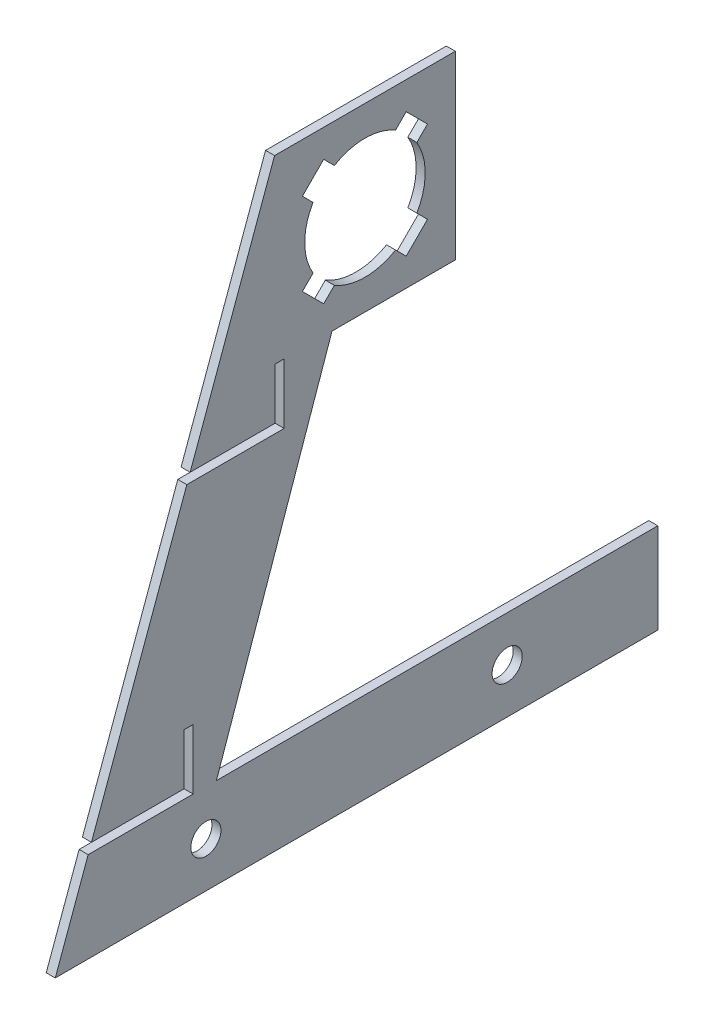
SolidWorks part; units mm, degrees
ref_plane "Front Plane" through (0, 0, 0) normal (0, 0, 1) x (1, 0, 0)
ref_plane "Top Plane" through (0, 0, 0) normal (0, 1, 0) x (1, 0, 0)
ref_plane "Right Plane" through (0, 0, 0) normal (1, 0, 0) x (0, 0, -1)
sketch "Sketch1" plane through (0, 0, 0) normal (1, 0, 0) x (0, 0, -1)
  line L0 (-67.0967, -58.2763) -> (-28.7102, 51.754)
  line L1 (-74.8056, -58.2763) -> (-109.6638, -58.2763)
  line L2 (12.2221, 111.754) -> (-47.7779, 111.754)
  line L3 (79.4281, -88.2763) -> (-120.5829, -88.2763)
  line L4 (79.4281, -58.2763) -> (79.4281, -88.2763)
  line L5 (-120.5719, -88.246) -> (-109.6638, -58.2763)
  line L6 (12.2221, 111.754) -> (12.2221, 51.754)
  line L7 (-67.0967, -58.2763) -> (79.4281, -58.2763)
  line L8 (12.2221, 51.754) -> (-28.7102, 51.754)
  line L9 (-108.5719, -55.2763) -> (-76.9065, 31.7237)
  line L10 (-74.8056, -58.2763) -> (-74.8056, -38.2763)
  line L11 (-74.8056, -38.2763) -> (-77.8056, -38.2763)
  line L12 (-77.8056, -38.2763) -> (-77.8056, -55.2763)
  line L13 (-77.8056, -55.2763) -> (-108.5719, -55.2763)
  line L14 (-120.5719, -88.246) -> (-120.5829, -88.2763)
  line L15 (-44.5924, 31.7237) -> (-76.9065, 31.7237)
  line L16 (-75.8146, 34.7237) -> (-47.7779, 111.754)
  line L17 (-44.5924, 51.7237) -> (-44.5924, 31.7237)
  line L18 (-44.5924, 51.7237) -> (-47.5924, 51.7237)
  line L19 (-27.9354, 64.5254) -> (-31.4709, 60.9898)
  line L20 (-47.5924, 51.7237) -> (-47.5924, 34.7237)
  line L21 (2.9863, 68.0609) -> (-4.0848, 60.9898)
  line L22 (-31.4709, 60.9898) -> (-38.542, 68.0609)
  line L23 (-38.542, 68.0609) -> (-35.0065, 71.5964)
  line L24 (2.9863, 95.447) -> (-0.5493, 91.9115)
  line L25 (2.9863, 68.0609) -> (-0.5493, 71.5964)
  line L26 (2.9863, 95.447) -> (-4.0848, 102.5181)
  line L27 (-4.0848, 60.9898) -> (-7.6203, 64.5254)
  line L28 (-75.8146, 34.7237) -> (-47.5924, 34.7237)
  line L29 (-35.0065, 91.9115) -> (-38.542, 95.447)
  line L30 (-27.9354, 98.9825) -> (-31.4709, 102.5181)
  line L31 (-38.542, 95.447) -> (-31.4709, 102.5181)
  line L32 (-7.6203, 98.9825) -> (-4.0848, 102.5181)
  arc A0 (-35.0065, 91.9115) -> (-35.0065, 71.5964) centre (-17.7779, 81.754) ccw
  arc A1 (-7.6203, 98.9825) -> (-27.9354, 98.9825) centre (-17.7779, 81.754) ccw
  arc A2 (-27.9354, 64.5254) -> (-7.6203, 64.5254) centre (-17.7779, 81.754) ccw
  arc A3 (-0.5493, 71.5964) -> (-0.5493, 91.9115) centre (-17.7779, 81.754) ccw
  circle A4 centre (29.4281, -73.2763) radius 5
  circle A5 centre (-70.5719, -73.2763) radius 5
extrude "Boss-Extrude1" add sketch "Sketch1" along normal blind 3
